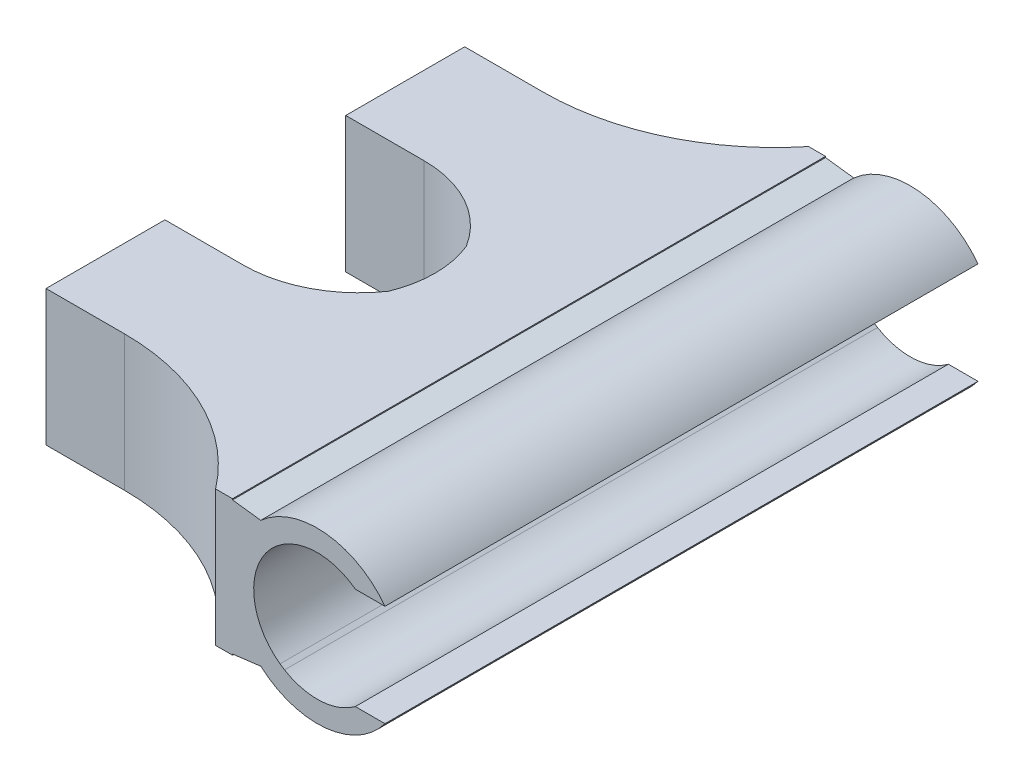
SolidWorks part; units mm, degrees
ref_plane "Alzado" through (0, 0, 0) normal (0, 0, 1) x (1, 0, 0)
ref_plane "Planta" through (0, 0, 0) normal (0, 1, 0) x (1, 0, 0)
ref_plane "Vista lateral" through (0, 0, 0) normal (1, 0, 0) x (0, 0, -1)
sketch "Croquis2" plane through (0, 0, 0) normal (0, 0, 1) x (1, 0, 0)
  line L0 (-0.0042, 0) -> (8.9958, 0) construction
  line L1 (4.4958, 0) -> (4.4958, -8.9303) construction
  line L2 (4.4958, -8.9303) -> (4.4958, 8.9303) construction
  line L3 (4.4958, -6) -> (7.9958, -6)
  line L4 (4.4958, 6) -> (7.9958, 6)
  line L5 (-10.0042, 0) -> (-8, 0) construction
  line L6 (-8, 0) -> (-10.0042, 0) construction
  arc A0 (4.4958, 6) -> (4.4958, -6) centre (-0.0042, 0) ccw
  arc A1 (7.9958, 6) -> (7.9958, -6) centre (-0.0042, 0) ccw
  dimension "D1" = 7.5
  dimension "D2" = 10
extrude "Saliente-Extruir1" add sketch "Croquis2" along normal blind 70
sketch "Croquis4" plane through (0, 8, 0) normal (0, -1, 0) x (-1, 0, 0)
  line L0 (12, 0) -> (12, -35) construction
  line L1 (21.1014, -35) -> (45.3986, -35) construction
  line L2 (12, -35) -> (12, -70) construction
  line L3 (12, -17.5) -> (54.5, -17.5) construction
  line L4 (12, -52.5) -> (54.5, -52.5) construction
  line L5 (54.5, -17.5) -> (54.5, -24.14)
  line L6 (54.5, -17.5) -> (54.5, -10.1)
  line L7 (54.5, -10.1) -> (44.5584, -10.1)
  line L8 (54.5, -24.14) -> (44.48, -24.14)
  line L9 (54.5, -52.5) -> (54.5, -59.52)
  line L10 (54.5, -52.5) -> (54.5, -45.48)
  line L11 (54.5, -45.48) -> (44.48, -45.48)
  line L12 (54.5, -59.52) -> (44.48, -59.52)
  line L13 (33.25, -17.5) -> (33.25, 5.3409) construction
  line L14 (33.25, -17.5) -> (33.25, -83.9492) construction
  line L15 (44.5584, -10.1) -> (33.25, -10.1) construction
  line L16 (44.5584, -10.1) -> (33.25, -10.1)
  line L17 (44.48, -24.14) -> (33.25, -24.14)
  line L18 (44.48, -24.14) -> (33.25, -24.14) construction
  line L19 (44.48, -45.48) -> (33.25, -45.48)
  line L20 (44.48, -59.52) -> (33.25, -59.52)
  line L21 (44.48, -45.48) -> (33.25, -45.48) construction
  line L22 (44.48, -59.52) -> (33.25, -59.52) construction
  line L28 (12, -70) -> (10, -70)
  line L30 (10, -70) -> (10, 0)
  line L31 (10, 0) -> (12, 0)
  arc A0 (22, -30.4145) -> (22, -39.5855) centre (33.25, -35) ccw
  arc A1 (33.25, -10.1) -> (12, 0) centre (33.25, 17.3046) cw
  arc A2 (33.25, -59.52) -> (12, -70) centre (33.25, -86.304) ccw
  arc A3 (33.25, -24.14) -> (22, -30.4145) centre (33.25, -37.3627) ccw
  arc A4 (33.25, -45.48) -> (22, -39.5855) centre (33.25, -31.7971) cw
  dimension "D7" = 12.1486
  dimension "D1" = 14.04
  dimension "D2" = 14.04
  dimension "D3" = 35
  dimension "D4" = 10.02
  dimension "D6" = 21.25
extrude "Saliente-Extruir3" add sketch "Croquis4" along normal blind 16 separate body
ref_plane "Plano1" through (-54.5, 8, 10.1) normal (0, 1, 0) x (1, 0, 0)
sketch "Croquis7" plane through (0, -8, 0) normal (0, -1, 0) x (1, 0, 0)
  line L0 (-54.5, 45.48) -> (-54.5, 24.14) construction
sketch3d "Croquis3D2" plane through (0, 0, 0) normal (0, 0, 1) x (1, 0, 0)
sketch "Croquis8" plane through (0, 0, 70) normal (0, 0, 1) x (1, 0, 0)
  line L0 (-11, 8) -> (-11, -8)
  line L1 (-10, 8) -> (-12, 8) construction
  line L2 (-10, -8) -> (-12, -8) construction
  line L3 (-11, -8) -> (-3, -7)
  line L4 (-3, -7) -> (-7, -4.3631)
  line L5 (-7, 4.567) -> (-10.0042, 0)
  line L6 (-10.0042, 0) -> (-7, -4.3631)
  line L7 (-7, 4.567) -> (-3, 7)
  line L8 (-3, 7) -> (-11, 8)
  arc A0 (7.9958, 6) -> (7.9958, -6) centre (-0.0042, 0) ccw construction
extrude "Saliente-Extruir4" add sketch "Croquis8" against normal up to surface (70 mm away)
sketch "Croquis9" plane through (0, 8, 0) normal (0, 1, 0) x (1, 0, 0)
  line L0 (-54.5, -10.1) -> (-54.5, -24.14)
  line L1 (-54.5, -10.1) -> (-47.5, -10.1)
  line L2 (-54.5, -10.1) -> (-33.25, -10.1) construction
  line L3 (-54.5, -24.14) -> (-47.5, -24.14)
  line L4 (-33.25, -24.14) -> (-54.5, -24.14) construction
  line L5 (-47.5, -24.14) -> (-47.5, -10.1)
  line L6 (-54.5, -45.48) -> (-47.5, -45.48)
  line L8 (-54.5, -45.48) -> (-33.25, -45.48) construction
  line L10 (-47.5, -45.48) -> (-47.5, -59.52)
  line L11 (-54.5, -59.52) -> (-54.5, -45.48)
  line L12 (-33.25, -59.52) -> (-54.5, -59.52) construction
  line L13 (-47.5, -59.52) -> (-54.5, -59.52)
extrude "Cortar-Extruir1" cut sketch "Croquis9" against normal blind 16
sketch "Croquis10" plane through (0, -8, 0) normal (0, -1, 0) x (1, 0, 0)
  line L0 (-47.5, 59.52) -> (-47.5, 45.48)
  line L1 (-47.5, 45.48) -> (-42.5, 45.48)
  line L2 (-47.5, 45.48) -> (-33.25, 45.48) construction
  line L3 (-42.5, 45.48) -> (-42.5, 59.52)
  line L4 (-33.25, 59.52) -> (-47.5, 59.52) construction
  line L5 (-42.5, 59.52) -> (-47.5, 59.52)
  line L6 (-47.5, 24.14) -> (-42.5, 24.14)
  line L7 (-33.25, 24.14) -> (-47.5, 24.14) construction
  line L8 (-42.5, 24.14) -> (-42.5, 10.1)
  line L9 (-47.5, 10.1) -> (-33.25, 10.1) construction
  line L10 (-42.5, 10.1) -> (-47.5, 10.1)
  line L11 (-47.5, 10.1) -> (-47.5, 24.14)
extrude "Cortar-Extruir2" cut sketch "Croquis10" against normal blind 16
sketch "Croquis11" plane through (0, 0, 59.52) normal (0, 0, 1) x (1, 0, 0)
  line L0 (0, 0) -> (-42.5, 0) construction
  line L1 (-42.5, 8) -> (-42.5, -8) construction
